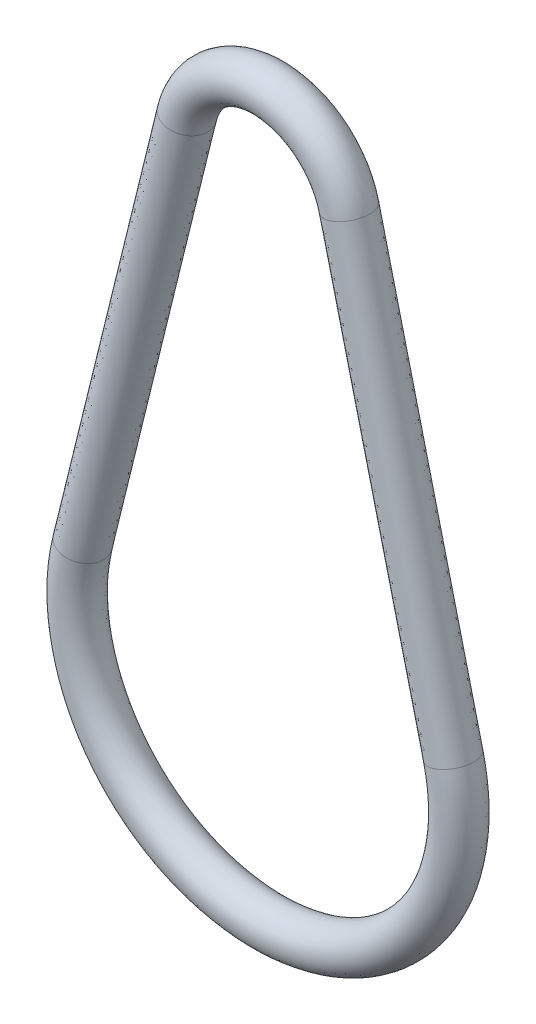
SolidWorks part; units mm, degrees
ref_plane "Front" through (0, 0, 0) normal (0, 0, 1) x (1, 0, 0)
ref_plane "Top" through (0, 0, 0) normal (0, 1, 0) x (1, 0, 0)
ref_plane "Right" through (0, 0, 0) normal (1, 0, 0) x (0, 0, -1)
sketch "Sketch1" plane through (0, 0, 0) normal (0, 0, 1) x (1, 0, 0)
  line L0 (0, 0) -> (0, 20.9) construction
  line L1 (-3.7868, 21.833) -> (-8.6416, 2.1292)
  line L2 (3.7868, 21.833) -> (8.6416, 2.1292)
  line L3 (-8.9, 0) -> (8.9, 0) construction
  arc A0 (3.7868, 21.833) -> (-3.7868, 21.833) centre (0, 20.9) ccw
  arc A1 (-8.6416, 2.1292) -> (8.6416, 2.1292) centre (0, 0) ccw
  dimension "D2" = 3.9
  dimension "D3" = 8.9
  dimension "D1" = 20.9
sketch "Sketch3" plane through (0, 0, 0) normal (0, 1, 0) x (1, 0, 0)
  circle A0 centre (-8.9, 0) radius 1
sweep "Sweep1" add profiles "Sketch3" path "Sketch1"
sketch "Sketch4" plane through (0, 0, 0) normal (0, 1, 0) x (1, 0, 0)
  circle A0 centre (0, 0) radius 0.001
extrude "Cut-Extrude1" cut sketch "Sketch4" against normal mid plane 141
